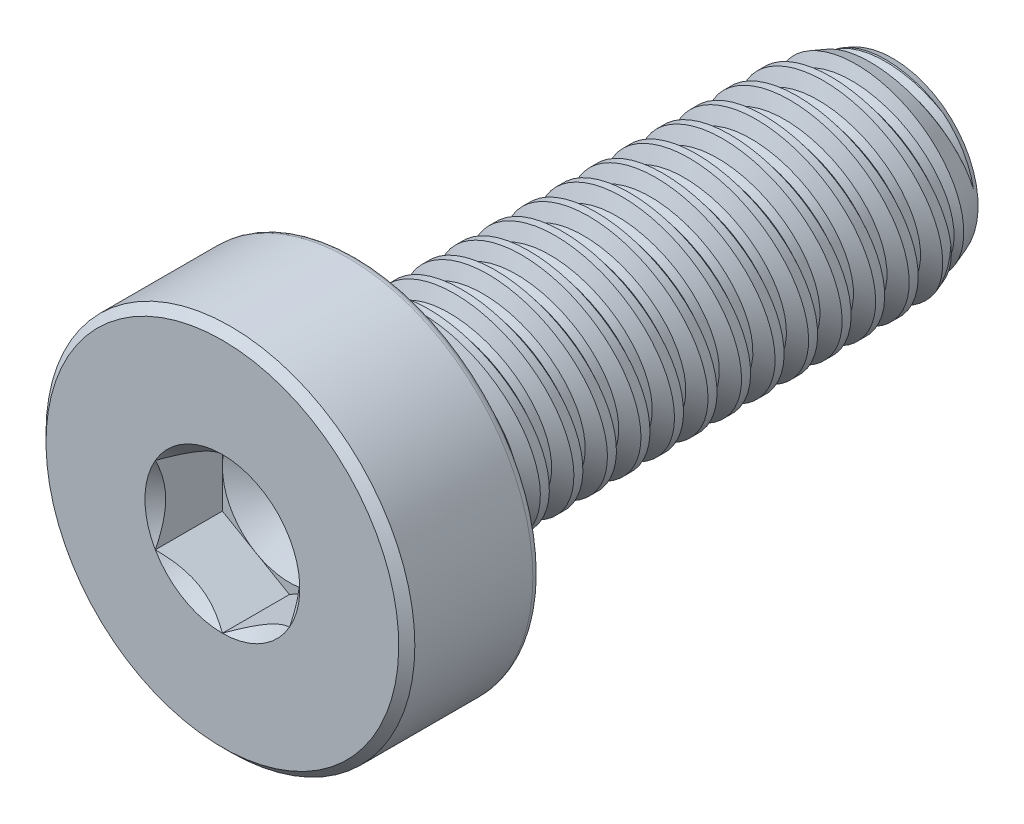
SolidWorks part; units mm, degrees
ref_plane "Front" through (0, 0, 0) normal (0, 0, 1) x (1, 0, 0)
ref_plane "Top" through (0, 0, 0) normal (0, 1, 0) x (1, 0, 0)
ref_plane "Right" through (0, 0, 0) normal (1, 0, 0) x (0, 0, -1)
sketch "Sketch1" plane through (0, 0, 0) normal (1, 0, 0) x (0, 0, -1)
  line L0 (0, 0) -> (-2, 0) construction
  line L1 (0, 0) -> (8, 0)
  line L2 (0, 0) -> (0, 1.5)
  line L3 (0, 1.5) -> (8, 1.5)
  line L4 (8, 0) -> (8, 1.5)
  line L5 (0, -1.5) -> (8, -1.5) construction
  line L6 (-2, 2.75) -> (-2, -2.75) construction
  line L7 (-2, 0) -> (-4, 0) construction
  dimension "Thread Dia" = 3
  dimension "Min Thread Length" = 8
  dimension "Head Height" = 2
  dimension "Head Dia" = 5.5
revolve "Revolve1" add sketch "Sketch1" angle 360 about L0
sketch "Sketch2" plane through (0, 0, 0) normal (1, 0, 0) x (0, 0, -1)
  line L0 (0, 1.5) -> (0, -1.5) construction
  line L1 (0, -1.5) -> (0.5, -1.5) construction
  line L2 (0.5, -1.5) -> (0, 1.5) construction
  line L3 (0, 1.5) -> (0.0616, 1.5103) construction
  line L4 (0.0616, 1.5103) -> (0.4932, 1.5822)
  line L5 (0.4932, 1.5822) -> (0.3836, 1.2896)
  line L6 (0.3836, 1.2896) -> (0.2603, 1.269)
  line L7 (0.2603, 1.269) -> (0.0616, 1.5103)
  line L8 (0.3219, 1.2793) -> (0.2774, 1.5462) construction
  line L9 (0, -1.5) -> (8, -1.5) construction
  line L10 (0, 1.5) -> (8, 1.5) construction
  line L12 (0.2851, 1.5) -> (0.7851, -1.5) construction
  line L13 (0, -0.0892) -> (1.0703, 0.0892) construction
  line L15 (0, 0) -> (0, 1.5) construction
  point P19 (0.5351, 0)
  dimension "D1" = 60
  dimension "Thread Pitch" = 0.5
  dimension "D2" = 0.0625
  dimension "D3" = 0.125
  dimension "D4" = 0.5
revolve "Cut-Revolve1" cut sketch "Sketch2" angle 360 about L13
sketch "Sketch3" plane through (0, 0, 0) normal (1, 0, 0) x (0, 0, -1)
  line L0 (8, 1.269) -> (7.3654, 1.5)
  line L1 (7.3654, 1.5) -> (8, 1.5)
  line L2 (8, 1.5) -> (8, 1.269)
  line L3 (0, 1.5) -> (8, 1.5) construction
  line L4 (8, 0) -> (8, 1.5) construction
  line L5 (7.3654, 0) -> (0, 0) construction
  line L6 (7.3654, 1.5) -> (7.3654, -1.5) construction
  line L7 (0, -1.5) -> (8, -1.5) construction
  dimension "D1" = 20
  dimension "D2" = 3
revolve "Cut-Revolve2" cut sketch "Sketch3" angle 360 about L5
pattern_linear "LPattern1" count 16 spacing 0.5 along (0, 0, 1) count 2 spacing 0.5 along (0, 0, 1)
ref_plane "Plane1" through (0, 0, 0) normal (0, 0, 1) x (1, 0, 0)
sketch "Sketch4" plane through (0, 0, 0) normal (0, 0, 1) x (1, 0, 0)
  circle A0 centre (0, 0) radius 2.75
  dimension "D1" = 5.5
extrude "Extrude1" add sketch "Sketch4" along normal up to vertex
sketch "Sketch10" plane through (0, 0, 0) normal (1, 0, 0) x (0, 0, -1)
  line L0 (-2, 2.63) -> (-1.88, 2.75)
  line L1 (-1.88, 2.75) -> (-0.12, 2.75)
  line L2 (0, 2.63) -> (0.1, 2.63)
  line L3 (0.1, 2.63) -> (0.1, 2.85)
  line L4 (0.1, 2.85) -> (-2, 2.85)
  line L5 (-2, 2.85) -> (-2, 2.63)
  line L7 (0, 2.75) -> (-2, 2.75) construction
  line L9 (0, 2.63) -> (-2, 2.63) construction
  line L10 (-2, 0) -> (-4, 0) construction
  line L11 (0, -2.75) -> (0, 2.75) construction
  line L12 (-2, 2.75) -> (-2, -2.75) construction
  arc A0 (-0.12, 2.75) -> (0, 2.63) centre (-0.12, 2.63) cw
  dimension "D1" = 45
  dimension "D2" = 0.1
  dimension "D3" = 0.1
  dimension "D4" = 0.12
  dimension "D5" = 2
  dimension "D6" = 8
revolve "Cut-Revolve3" cut sketch "Sketch10" angle 360 about L10
sketch "Sketch6" plane through (0, 0, 2) normal (0, 0, 1) x (1, 0, 0)
  line L1 (0, -1.1547) -> (1, -0.5774)
  line L2 (1, -0.5774) -> (1, 0.5774)
  line L3 (1, 0.5774) -> (0, 1.1547)
  line L4 (0, 1.1547) -> (-1, 0.5774)
  line L5 (-1, 0.5774) -> (-1, -0.5774)
  line L6 (-1, -0.5774) -> (0, -1.1547)
  circle A0 centre (0, 0) radius 1 construction
  dimension "Hex" = 2
extrude "Cut-Extrude1" cut sketch "Sketch6" against normal blind 1
sketch "Sketch7" plane through (0, 0, 2) normal (0, 0, 1) x (1, 0, 0)
  circle A0 centre (0, 0) radius 1.1547
extrude "Cut-Extrude4" cut sketch "Sketch7" against normal blind 1 draft 45
sketch "Sketch8" plane through (0, 0, 1) normal (0, 0, 1) x (1, 0, 0)
  circle A0 centre (0, 0) radius 1 construction
  circle A1 centre (0, 0) radius 1
extrude "Cut-Extrude5" cut sketch "Sketch8" against normal blind 0.3333 draft 60
equation "\"D2@Sketch2\"=\"Thread Pitch@Sketch2\"/8"
equation "\"D3@Sketch2\"=\"Thread Pitch@Sketch2\"/4"
equation "\"D4@Sketch2\"=\"Thread Pitch@Sketch2\""
equation "\"D3@LPattern1\"=\"Thread Pitch@Sketch2\""
equation "\"D1@Cut-Extrude4\"=\"D1@Cut-Extrude1\""
equation "\"D1@Cut-Extrude5\"=\"D1@Cut-Extrude1\"/3"
equation "\"D1@LPattern1\"=\"Min Thread Length@Sketch1\"/\"Thread Pitch@Sketch2\""
equation "\"D4@LPattern1\"=\"Thread Pitch@Sketch2\""
equation "\"D4@Sketch10\"=\"Thread Dia@Sketch1\"/25"
equation "\"D1@Cut-Extrude1\"=\"Head Height@Sketch1\"/2"
